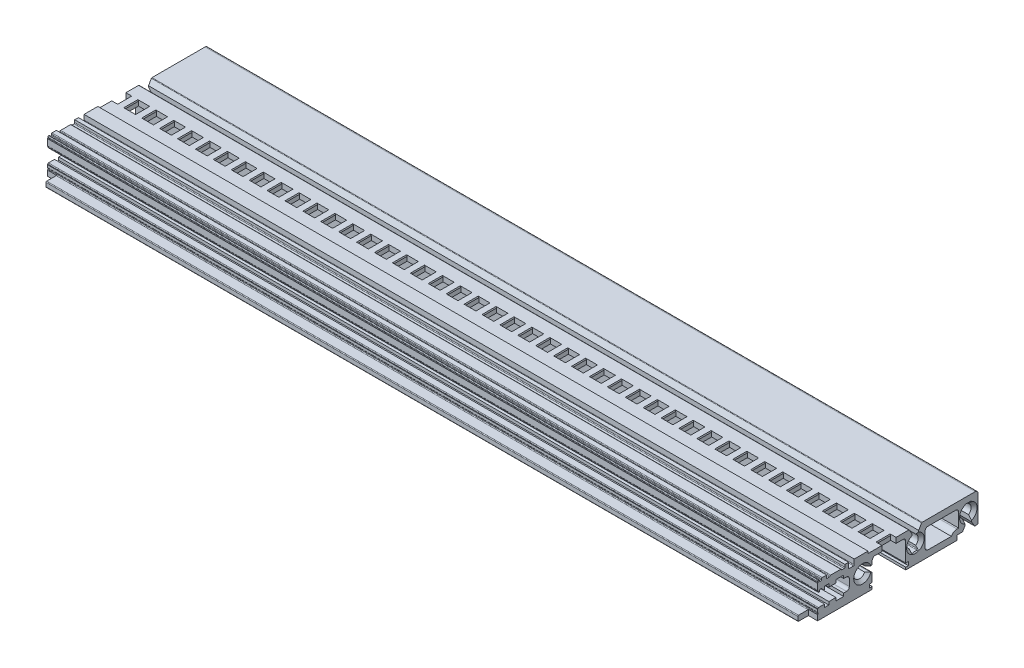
SolidWorks part; units mm, degrees
other "34566284"
ref_plane "前视基准面" through (0, 0, 0) normal (0, 0, 1) x (1, 0, 0)
ref_plane "上视基准面" through (0, 0, 0) normal (0, 1, 0) x (1, 0, 0)
ref_plane "右视基准面" through (0, 0, 0) normal (1, 0, 0) x (0, 0, -1)
imported_body "输入1"
sketch "草图1" plane through (0, 0, 0) normal (0, 1, 0) x (1, 0, 0)
  line L0 (-215.9, 9.4065) -> (-215.9, 24.45) construction
  line L1 (215.9, 38.2696) -> (2.54, 38.2696)
  line L2 (215.9, 38.2696) -> (215.9, -28.5682)
  line L3 (215.9, -28.5682) -> (2.54, -28.5682)
  line L4 (2.54, 38.2696) -> (2.54, -28.5682)
  line L5 (215.9, 9.4065) -> (215.9, 24.45) construction
  dimension "D1" = 218.44
extrude "切除-拉伸1" cut sketch "草图1" against normal mid plane 37
sketch "草图2" plane through (2.54, 0, 0) normal (1, 0, 0) x (0, 0, -1)
  circle A0 centre (-7.5, -4.2) radius 1.65
  circle A1 centre (7.5, -4.2) radius 1.65
  circle A2 centre (22.5, -4.2) radius 1.65
extrude "切除-拉伸2" cut sketch "草图2" against normal blind 15.02
chamfer "倒角1" distance 0.85 angle 45 4 edges at (2.54, -4.2, -24.15) (2.54, -4.2, -20.85) (2.54, -4.2, -5.85) (2.54, -4.2, 9.15)
sketch "草图3" plane through (0, -7.9, 0) normal (0, 1, 0) x (1, 0, 0)
  line L1 (2.54, -23.25) -> (-0.06, -23.25)
  line L2 (2.54, -23.25) -> (2.54, -20.25)
  line L3 (2.54, -20.25) -> (-0.06, -20.25)
  line L4 (-0.06, -23.25) -> (-0.06, -20.25)
  dimension "D1" = 3
  dimension "D2" = 2.6
extrude "切除-拉伸3" cut sketch "草图3" against normal mid plane 10
